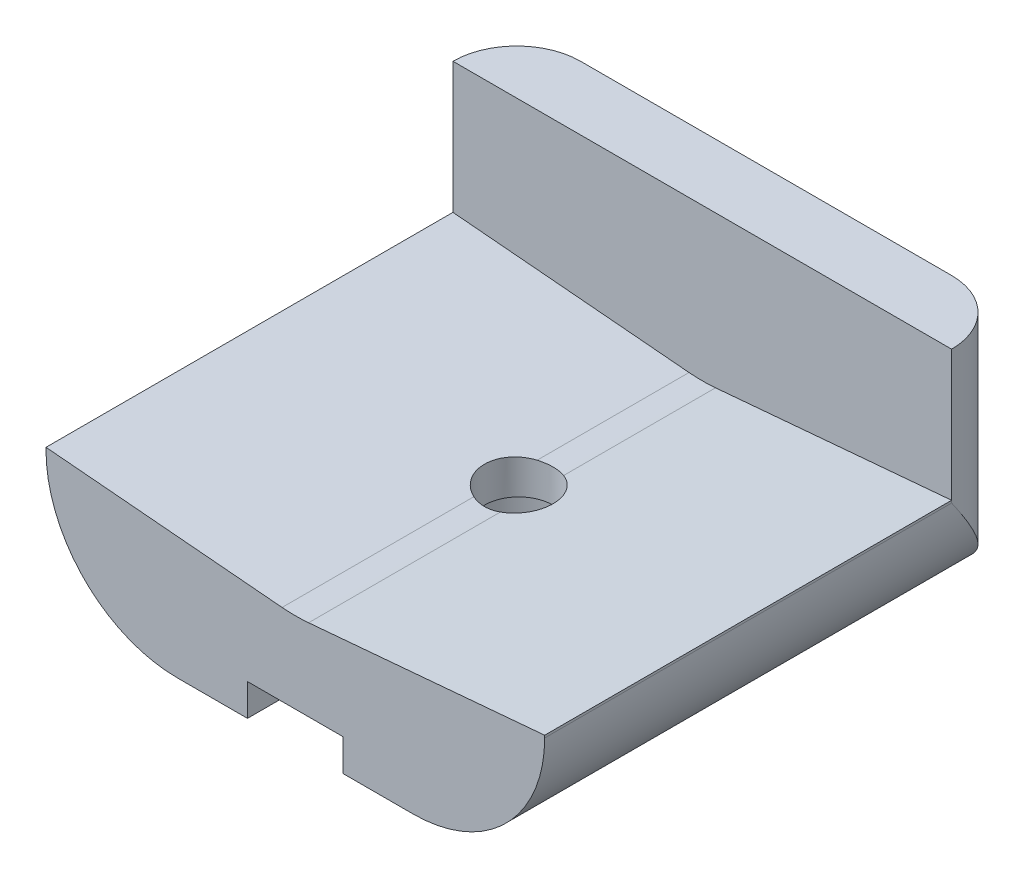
SolidWorks part; units mm, degrees
ref_plane "Plan de face" through (0, 0, 0) normal (0, 0, 1) x (1, 0, 0)
ref_plane "Plan de dessus" through (0, 0, 0) normal (0, 1, 0) x (1, 0, 0)
ref_plane "Plan de droite" through (0, 0, 0) normal (1, 0, 0) x (0, 0, -1)
sketch "Esquisse1" plane through (0, 0, 0) normal (0, 0, 1) x (1, 0, 0)
  line L1 (0, 0) -> (31.25, 0)
  line L2 (0, 0) -> (0, 16.6)
  line L3 (0, 16.6) -> (31.25, 16.6)
  line L4 (31.25, 0) -> (31.25, 16.6)
  dimension "D1" = 16.6
  dimension "D2" = 31.25
extrude "Boss.-Extru.1" add sketch "Esquisse1" along normal blind 59
fillet "Congé1" radius 8.25 2 edges at (31.25, 0, 29.5) (0, 0, 29.5)
fillet "Congé2" radius 4 4 edges at (0, 12.425, 0) (31.25, 12.425, 0) (31.25, 12.425, 59) (0, 12.425, 59)
fillet "Congé3" radius 1 2 edges at (15.625, 0, 0) (15.625, 0, 59)
sketch "Esquisse3" plane through (0, 0, 59) normal (0, 0, 1) x (1, 0, 0)
  line L0 (0, 8.25) -> (0, 16.6) construction
  line L1 (23, 0) -> (8.25, 0) construction
  line L2 (31.25, 16.6) -> (31.25, 8.25) construction
  line L3 (31.25, 16.6) -> (27.25, 16.6) construction
  line L4 (0, 8.25) -> (0, 16.6)
  line L5 (23, 0) -> (8.25, 0)
  line L6 (31.25, 16.6) -> (31.25, 8.25)
  line L7 (31.25, 16.6) -> (0, 16.6)
  arc A3 (27.25, 1.1789) -> (31.25, 8.25) centre (23, 8.25) ccw construction
  arc A4 (0, 8.25) -> (4, 1.1789) centre (8.25, 8.25) ccw construction
  arc A5 (0, 8.25) -> (4, 1.1789) centre (8.25, 8.25) ccw
  arc A6 (23, 0) -> (27.25, 1.1789) centre (23, 8.25) ccw
  arc A7 (27.25, 1.1789) -> (31.25, 8.25) centre (23, 8.25) ccw
  arc A8 (4.313, 1) -> (8.25, 0) centre (8.25, 8.25) ccw construction
  arc A9 (4, 1.1789) -> (8.25, 0) centre (8.25, 8.25) ccw
extrude "Enlèv. mat.-Extru.2" cut sketch "Esquisse3" against normal blind 29.5
sketch "Esquisse4" plane through (0, 0, 29.5) normal (0, 0, 1) x (1, 0, 0)
  line L0 (0, 16.6) -> (31.25, 16.6)
  line L1 (31.25, 16.6) -> (31.25, 8.4)
  line L2 (31.25, 8.25) -> (31.25, 16.6) construction
  line L3 (31.25, 8.4) -> (16.4556, 7.1057)
  line L4 (14.7944, 7.1057) -> (0, 8.4)
  line L5 (0, 16.6) -> (0, 8.25) construction
  line L6 (0, 8.4) -> (0, 16.6)
  arc A0 (14.7944, 7.1057) -> (16.4556, 7.1057) centre (15.625, 16.6) ccw
  dimension "D1" = 8.2
  dimension "D2" = 5
extrude "Enlèv. mat.-Extru.3" cut sketch "Esquisse4" against normal blind 25.5
hole_wizard "Chambrage pour vis à tête cylindrique à 6 pans creux (ou vis CHC) M41" positions "Esquisse10" profile "Esquisse11" counterbore size "M4" standard "Ansi Metric"
sketch "Esquisse10" plane through (0, 0, 0) normal (0, -1, 0) x (1, 0, 0)
  line L0 (15.625, 29.5) -> (15.625, 7.6024) construction
  line L1 (8.25, 29.5) -> (23, 29.5) construction
  point P0 (15.625, 15.5)
  dimension "D1" = 14
sketch "Esquisse11" plane through (15.625, 0, 15.5) normal (1, 0, 0) x (0, 0, -1)
  line L0 (0, 0) -> (0, 16.6)
  line L1 (0, 16.6) -> (2.15, 16.6)
  line L3 (2.15, 16.6) -> (2.15, 5)
  line L4 (2.15, 5) -> (4, 5)
  line L5 (4, 5) -> (4, 0)
  line L7 (4, 0) -> (0, 0)
  line L11 (0, -6.35) -> (0, 107.95) construction
  dimension "Diamètre du perçage jusqu'au prochain" = 4.3
  dimension "Profondeur du perçage jusqu'au prochain" = 16.6
  dimension "Diamètre du chambrage" = 8
  dimension "Profondeur du chambrage" = 5
sketch "Esquisse12" plane through (0, 0, 0) normal (0, -1, 0) x (1, 0, 0)
  line L0 (15.625, 23.5) -> (15.625, 35.5) construction
  line L1 (12.625, 23.5) -> (12.625, 35.5)
  line L2 (18.625, 23.5) -> (18.625, 35.5)
  line L3 (8.25, 29.5) -> (23, 29.5) construction
  arc A0 (12.625, 23.5) -> (18.625, 23.5) centre (15.625, 23.5) ccw
  arc A1 (18.625, 35.5) -> (12.625, 35.5) centre (15.625, 35.5) ccw
  point P2 (15.625, 29.5)
  dimension "D1" = 3
  dimension "D2" = 12
extrude "Enlèv. mat.-Extru.4" cut sketch "Esquisse12" against normal blind 2
